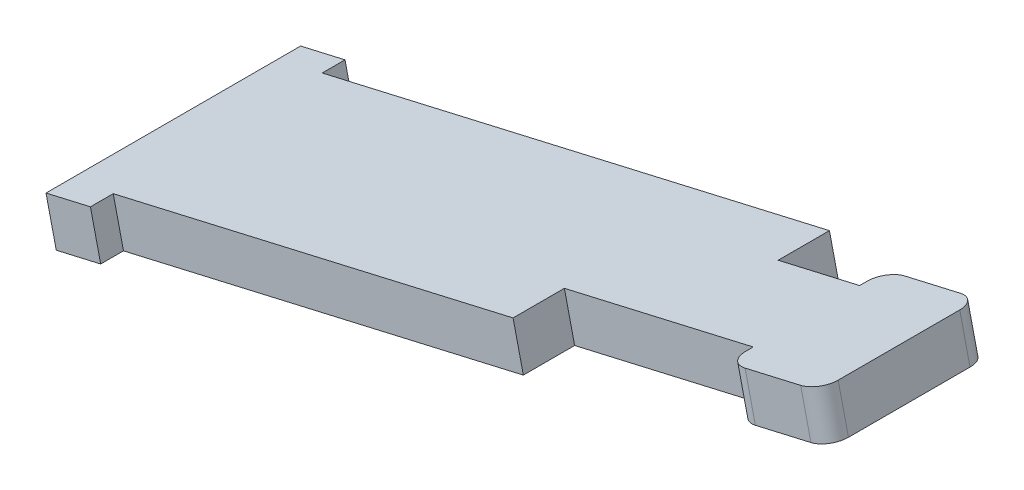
SolidWorks part; units mm, degrees
ref_plane "Front Plane" through (0, 0, 0) normal (0, 0, 1) x (1, 0, 0)
ref_plane "Top Plane" through (0, 0, 0) normal (0, 1, 0) x (1, 0, 0)
ref_plane "Right Plane" through (0, 0, 0) normal (1, 0, 0) x (0, 0, -1)
body saved out of another part "Stock-Toaster Test-1"
sketch "Sketch1" plane through (0, 0, 33.5) normal (0, 0, 1) x (1, 0, 0)
  circle A0 centre (-64.0393, -24.0295) radius 8.5
  dimension "D1" = 17
sketch "Sketch2" plane through (0, 0, -33.5) normal (0, 0, -1) x (-1, 0, 0)
  circle A0 centre (64.0393, -24.0295) radius 8.5 construction
  circle A1 centre (64.0393, -24.0295) radius 8.5
